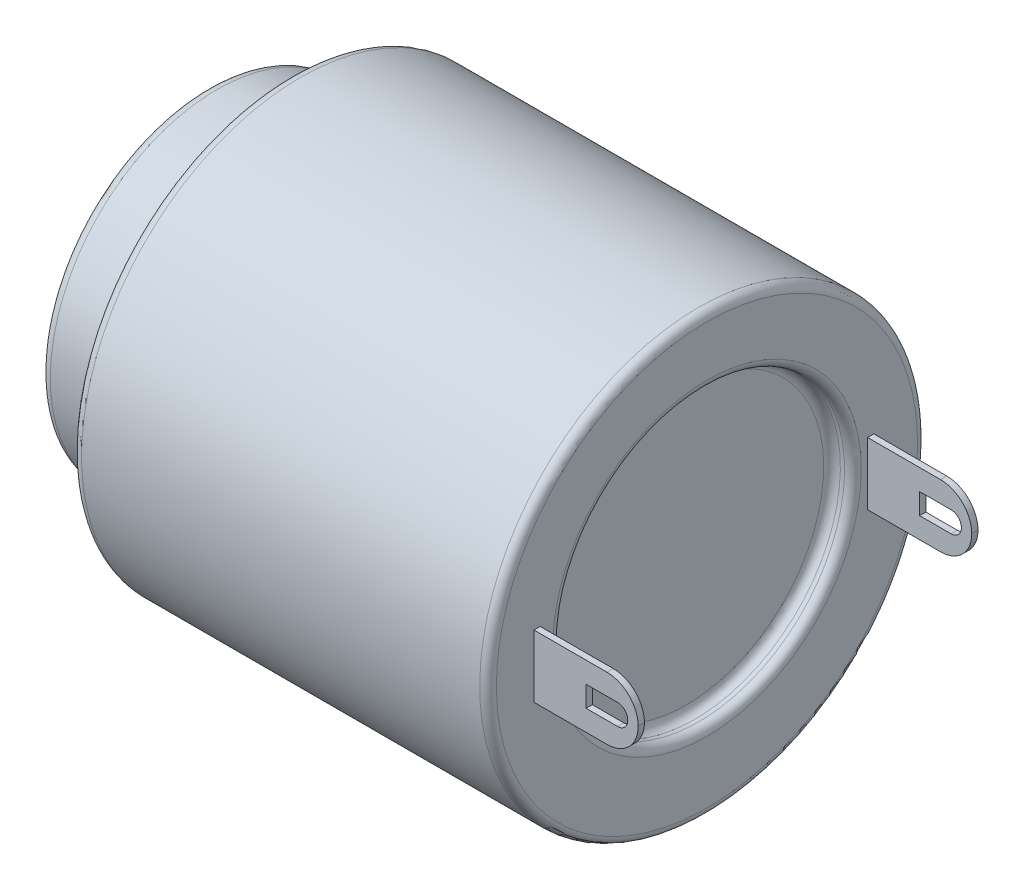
SolidWorks part; units mm, degrees
ref_plane "Plan de face" through (0, 0, 0) normal (0, 0, 1) x (1, 0, 0)
ref_plane "Plan de dessus" through (0, 0, 0) normal (0, 1, 0) x (1, 0, 0)
ref_plane "Plan de droite" through (0, 0, 0) normal (1, 0, 0) x (0, 0, -1)
sketch "Esquisse1" plane through (0, 0, 0) normal (0, 0, 1) x (1, 0, 0)
  line L0 (-74.9267, 11.731) -> (-74.9267, 14.731)
  line L1 (-74.9267, 14.731) -> (-72.9267, 14.731)
  line L2 (-72.9267, 14.731) -> (-72.9267, 19.731)
  line L3 (-72.9267, 19.731) -> (-68.9267, 19.731)
  line L4 (-68.9267, 19.731) -> (-68.9267, 22.231)
  line L5 (-68.9267, 22.231) -> (-48.9267, 22.231)
  line L6 (-48.9267, 22.231) -> (-48.9267, 11.731)
  line L7 (-48.9267, 11.731) -> (-74.9267, 11.731)
  dimension "D1" = 10.5
  dimension "D2" = 3
  dimension "D3" = 5
  dimension "D4" = 26
  dimension "D5" = 20
  dimension "D6" = 4
revolve "Révolution1" add sketch "Esquisse1" angle 360 about L7
fillet "Congé1" radius 0.5 5 edges at (-74.9267, 14.731, 0) (-72.9267, 14.731, 0) (-72.9267, 19.731, 0) (-68.9267, 19.731, 0) (-68.9267, 22.231, 0)
sketch "Esquisse2" plane through (-74.9267, 0, 0) normal (-1, 0, 0) x (0, 0, 1)
  circle A0 centre (0, 11.731) radius 1
  circle A29 centre (0, 11.731) radius 10.5 construction
  dimension "D1" = 2
  dimension "D2" = 10.5
extrude "Enlèv. mat.-Extru.1" cut sketch "Esquisse2" against normal blind 10
sketch "Esquisse3" plane through (-72.9267, 0, 0) normal (-1, 0, 0) x (0, 0, 1)
  circle A0 centre (0, 6.231) radius 1
  circle A1 centre (0, 16.731) radius 1
  circle A18 centre (0, 11.731) radius 10.5 construction
  dimension "D1" = 2
  dimension "D2" = 2
  dimension "D3" = 5
  dimension "D4" = 5
extrude "Enlèv. mat.-Extru.2" cut sketch "Esquisse3" against normal blind 10
sketch "Esquisse5" plane through (-48.9267, 0, 0) normal (1, 0, 0) x (0, 0, -1)
  line L0 (7.7, 13.1747) -> (8, 13.1747)
  line L1 (-8.3, 13.1747) -> (-8, 13.1747)
  line L2 (-8.3, 13.1747) -> (-8.3, 10.1747)
  line L3 (-8.3, 10.1747) -> (-8, 10.1747)
  line L4 (-8, 13.1747) -> (-8, 10.1747)
  line L5 (7.7, 13.1747) -> (7.7, 10.1747)
  line L6 (7.7, 10.1747) -> (8, 10.1747)
  line L7 (8, 13.1747) -> (8, 10.1747)
  line L8 (0, 11.6747) -> (-12.4731, 11.6747) construction
  circle A1 centre (0, 11.731) radius 10.5 construction
  dimension "D1" = 3
  dimension "D2" = 0.3
  dimension "D3" = 8
  dimension "D4" = 1.5
extrude "Extrusion1" add sketch "Esquisse5" along normal blind 5
sketch "Esquisse6" plane through (0, 0, 8.3) normal (0, 0, 1) x (1, 0, 0)
  line L0 (-43.9267, 13.1747) -> (-48.9267, 13.1747) construction
  line L1 (-46.4267, 12.1747) -> (-44.9167, 12.1747)
  line L2 (-46.4267, 12.1747) -> (-46.4267, 11.1747)
  line L3 (-46.4267, 11.1747) -> (-44.9167, 11.1747)
  line L4 (-44.4267, 11.6847) -> (-44.4267, 11.6647)
  arc A0 (-44.9167, 12.1747) -> (-44.4267, 11.6847) centre (-44.9167, 11.6847) cw
  arc A1 (-44.9167, 11.1747) -> (-44.4267, 11.6647) centre (-44.9167, 11.6647) ccw
  point P8 (-44.4267, 12.1747)
  dimension "D5" = 0.49
  dimension "D2" = 1
  dimension "D3" = 1
sketch "Esquisse7" plane through (-48.9267, 0, 0) normal (1, 0, 0) x (0, 0, -1)
  circle A0 centre (0, 12.0061) radius 7
  dimension "D1" = 14
extrude "Enlèv. mat.-Extru.4" cut sketch "Esquisse7" against normal blind 1
fillet "Congé6" radius 0.4 1 edges at (-49.9267, 19.0061, 0)
fillet "Congé7" radius 0.4 1 edges at (-48.9267, 19.0061, 0)
fillet "Congé8" radius 0.4 1 edges at (-48.9267, 22.231, 0)
extrude "Enlèv. mat.-Extru.5" cut sketch "Esquisse6" against normal through all
fillet "Congé9" radius 1.5 8 edges at (-43.9267, 11.6747, 8.3) (-43.9267, 10.1747, 8.15) (-43.9267, 11.6747, 8) (-43.9267, 13.1747, 8.15) (-43.9267, 11.6747, -7.7) (-43.9267, 10.1747, -7.85) (-43.9267, 11.6747, -8) (-43.9267, 13.1747, -7.85)
